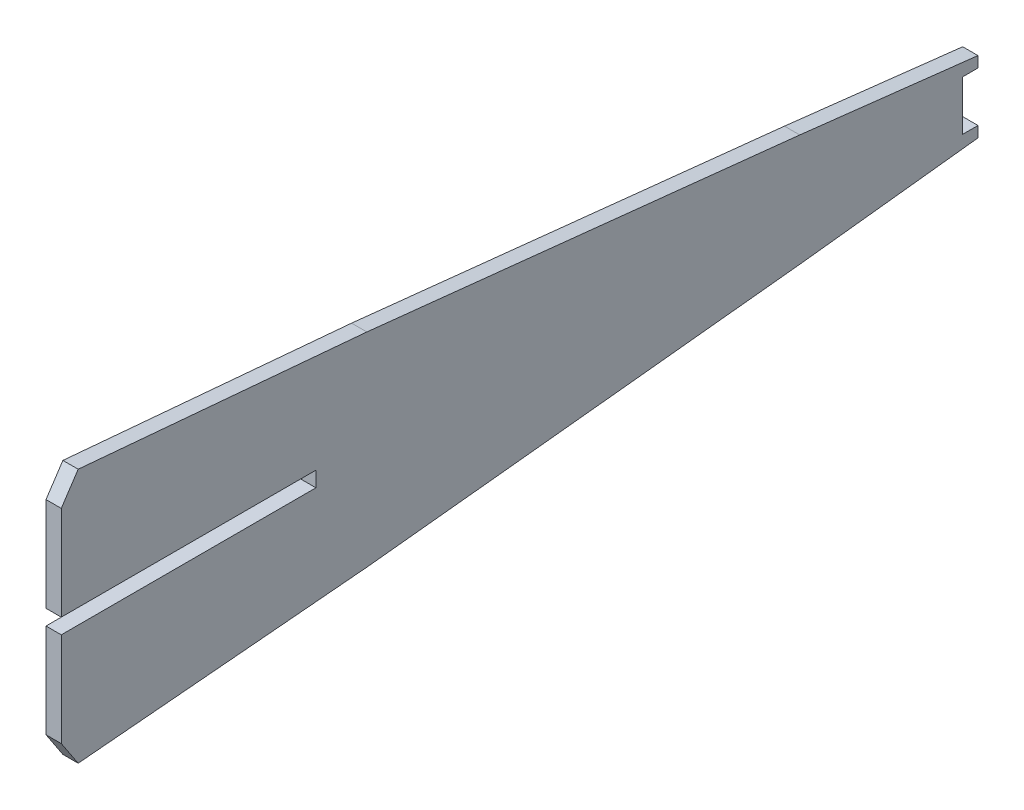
SolidWorks part; units mm, degrees
ref_plane "Alzado" through (0, 0, 0) normal (0, 0, 1) x (1, 0, 0)
ref_plane "Planta" through (0, 0, 0) normal (0, 1, 0) x (1, 0, 0)
ref_plane "Vista lateral" through (0, 0, 0) normal (1, 0, 0) x (0, 0, -1)
sketch "Croquis3" plane through (0, 0, 0) normal (1, 0, 0) x (0, 0, -1)
  line L0 (0, 0) -> (180, 0) construction
  line L1 (0, -20) -> (0, 20)
  line L2 (0, 20) -> (3.3166, 25)
  line L3 (3.3166, 25) -> (60, 20)
  line L4 (60, 20) -> (145, 11)
  line L5 (145, 11) -> (180, 7)
  line L6 (180, 7) -> (180, 4.885)
  line L7 (145, -11) -> (180, -7)
  line L8 (60, -20) -> (145, -11)
  line L9 (3.3166, -25) -> (60, -20)
  line L10 (0, -20) -> (3.3166, -25)
  line L11 (180, -4.885) -> (180, -7)
  line L12 (180, 4.885) -> (177, 4.885)
  line L14 (180, -4.885) -> (177, -4.885)
  line L15 (177, 4.885) -> (177, -4.885)
  point P17 (177, 0)
extrude "Saliente-Extruir1" add sketch "Croquis3" along normal blind 3
sketch "Croquis4" plane through (3, 0, 0) normal (1, 0, 0) x (0, 0, -1)
  line L0 (0, 20) -> (0, -20) construction
  line L1 (0, -1.5) -> (50, -1.5)
  line L2 (0, -1.5) -> (0, 1.5)
  line L3 (0, 1.5) -> (50, 1.5)
  line L4 (50, -1.5) -> (50, 1.5)
  point P6 (0, 0)
  dimension "D1" = 3
  dimension "D2" = 50
extrude "Cortar-Extruir1" cut sketch "Croquis4" against normal blind 10
equation "\"Grosor\"= 3mm"
equation "\"Kerf\"= 0.23"
equation "\"Slot\"= \"Grosor\" - \"Kerf\""
equation "\"D10@Croquis3\"=\"Grosor\""
equation "\"LargoD\"= 10 - \"Kerf\""
equation "\"D11@Croquis3\"=\"LargoD\""
equation "\"LargoDMacho\"= 10"
equation "\"D1@Saliente-Extruir1\"=\"Grosor\""
